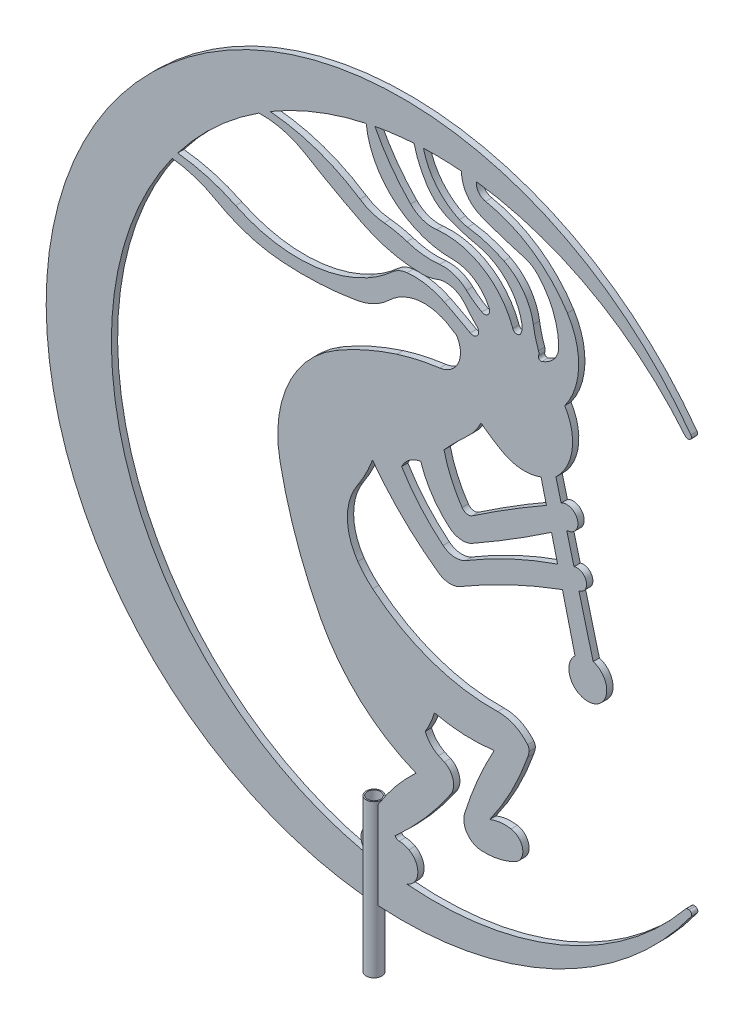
SolidWorks part; units mm, degrees
ref_plane "Front Plane" through (0, 0, 0) normal (0, 0, 1) x (1, 0, 0)
ref_plane "Top Plane" through (0, 0, 0) normal (0, 1, 0) x (1, 0, 0)
ref_plane "Right Plane" through (0, 0, 0) normal (1, 0, 0) x (0, 0, -1)
sketch "Model" plane through (0, 0, 0) normal (0, 0, 1) x (1, 0, 0)
  line L0 (121.8097, -137.6405) -> (107.3418, -82.7355)
  line L1 (68.9055, -1.7853) -> (74.3899, -24.0365)
  line L2 (90.642, -89.9748) -> (103.4341, -141.8749)
  line L3 (102.3813, -63.9103) -> (94.9941, -35.8763)
  line L4 (85.7104, -69.989) -> (85.7156, -69.9871)
  line L5 (107.3418, -82.7355) -> (107.5886, -82.6285)
  line L6 (79.5971, -45.1632) -> (85.7156, -69.9871)
  line L7 (89.3465, -14.4437) -> (84.0088, 5.8125)
  line L8 (218.8133, 106.219) -> (219.3212, 106.382)
  line L10 (219.2116, -307.2942) -> (218.6877, -307.1821)
  arc A0 (95.7332, 155.5808) -> (12.6305, 212.2913) centre (-11.4798, 87.7167) ccw
  arc A1 (8.2558, 196.9794) -> (52.0641, 182.6078) centre (178.4836, 641.9205) ccw
  arc A2 (-29.5648, -27.2149) -> (-5.8467, -3.3002) centre (227.3937, -258.3419) cw
  arc A3 (8.0143, 15.1922) -> (-5.8467, -3.3002) centre (-47.8361, 42.6139) cw
  arc A4 (29.2299, 1.0837) -> (68.9055, -1.7853) centre (52.0641, 41.087) ccw
  arc A5 (29.2299, 1.0837) -> (8.0143, 15.1922) centre (121.9361, 163.4954) cw
  arc A6 (52.0641, 182.6078) -> (65.2981, 174.6762) centre (44.4263, 154.8579) cw
  arc A7 (65.2981, 174.6762) -> (86.8758, 121.8798) centre (8.3347, 120.5878) cw
  arc A8 (-0.6887, -70.7111) -> (-11.2744, -68.6714) centre (-4.9624, -64.4021) cw
  arc A9 (-60.0703, 227.0897) -> (-99.7497, 222.082) centre (-38.8663, -100.6327) ccw
  arc A10 (-46.5893, 196.4008) -> (-60.0703, 227.0897) centre (35.7624, 250.8815) cw
  arc A11 (-14.1146, 183.0061) -> (-50.4739, 227.5698) centre (14.0002, 243.0593) cw
  arc A12 (-46.5893, 196.4008) -> (-24.0961, 178.1484) centre (-6.3186, 223.0423) ccw
  arc A13 (-24.0961, 178.1484) -> (3.9241, 169.7219) centre (39.4106, 338.5236) ccw
  arc A14 (3.9241, 169.7219) -> (49.5503, 123.0035) centre (-8.1491, 112.2919) cw
  arc A15 (12.6305, 212.2913) -> (3.3298, 225.0528) centre (14.8319, 223.6657) cw
  arc A16 (219.2116, -307.2942) -> (221.1211, -312.2576) centre (218.5471, -310.3989) cw
  arc A17 (-14.1146, 183.0061) -> (-5.5582, 180.5421) centre (-2.0774, 208.7175) ccw
  arc A18 (-5.5582, 180.5421) -> (31.342, 169.3123) centre (-19.3337, 69.036) cw
  arc A19 (31.342, 169.3123) -> (61.1081, 128.3223) centre (6.3519, 119.8622) cw
  arc A20 (61.1081, 128.3223) -> (66.3204, 107.8468) centre (170.0568, 145.1553) ccw
  arc A21 (66.3204, 107.8468) -> (66.3719, 103.3846) centre (59.91, 105.5413) cw
  arc A22 (66.3719, 103.3846) -> (69.6967, 100.1031) centre (68.8405, 102.5607) ccw
  arc A23 (69.6967, 100.1031) -> (81.0885, 107.3404) centre (59.9886, 127.9683) ccw
  arc A24 (86.8758, 121.8798) -> (81.0885, 107.3404) centre (66.5583, 121.5456) cw
  arc A25 (-103.9493, -422.5267) -> (-113.1901, -404.8498) centre (-100.2902, -409.36) cw
  arc A26 (-65.1573, -396.5896) -> (-67.154, -427.8197) centre (-73.4199, -411.7402) cw
  arc A27 (-65.1573, -396.5896) -> (-75.1065, -393.8665) centre (-75.8921, -416.2735) ccw
  arc A28 (-75.1065, -393.8665) -> (-79.2674, -391.326) centre (-74.9325, -388.9038) cw
  arc A29 (-39.317, -263.2371) -> (-48.6228, -284.1924) centre (-123.7076, -238.305) cw
  arc A30 (-39.317, -263.2371) -> (21.3409, -266.0287) centre (-1.4435, -100.6993) ccw
  arc A31 (-58.002, -325.6124) -> (-154.7207, -237.9942) centre (12.4799, -150.6184) cw
  arc A32 (-154.7207, -237.9942) -> (-196.0476, -120.592) centre (232.0704, -35.8647) cw
  arc A33 (-196.0476, -120.592) -> (-139.8027, 5.0686) centre (-79.2116, -97.4694) cw
  arc A34 (-139.8027, 5.0686) -> (-77.4813, 32.9433) centre (14.0327, -255.266) cw
  arc A35 (-77.4813, 32.9433) -> (-33.8564, 42.5936) centre (-2.052, -204.6097) cw
  arc A36 (-33.8564, 42.5936) -> (-16.4133, 79.074) centre (-36.9286, 66.473) ccw
  arc A37 (-16.4133, 79.074) -> (-18.4846, 80.9218) centre (-20.5275, 76.5469) ccw
  arc A38 (-18.4846, 80.9218) -> (-21.9659, 82.9295) centre (-8.6161, 102.0558) cw
  arc A39 (-21.9659, 82.9295) -> (-65.2774, 88.8876) centre (-49.4478, 43.5563) ccw
  arc A40 (-65.2774, 88.8876) -> (-85.2911, 76.5469) centre (-47.242, 37.2396) ccw
  arc A41 (-305.4745, 91.1267) -> (-103.9493, -422.5267) centre (-38.8663, -100.6327) ccw
  arc A42 (221.1211, -312.2576) -> (-433.4393, -100.6327) centre (-71.949, -100.6327) cw
  arc A43 (215.3849, 107.2324) -> (3.3298, 225.0528) centre (-38.8663, -100.6327) ccw
  arc A44 (220.9232, 111.2662) -> (-433.4393, -100.6327) centre (-71.949, -100.6327) ccw
  arc A45 (-106.7263, 85.4991) -> (-82.2289, 102.979) centre (-170.3417, 200.5596) ccw
  arc A46 (-82.2289, 102.979) -> (-67.154, 109.7518) centre (-64.1994, 83.0122) cw
  arc A47 (-67.154, 109.7518) -> (-29.2788, 102.979) centre (-59.69, 42.2021) cw
  arc A48 (-29.2788, 102.979) -> (-2.9225, 88.8876) centre (-276.6601, -391.4134) cw
  arc A49 (-2.9225, 88.8876) -> (3.9241, 97.8754) centre (-0.1003, 93.8394) ccw
  arc A50 (3.9241, 97.8754) -> (-8.1491, 111.4066) centre (113.7905, 208.056) cw
  arc A51 (-8.1491, 111.4066) -> (-36.9286, 119.0901) centre (-27.7021, 95.9088) ccw
  arc A52 (-36.9286, 119.0901) -> (-51.4493, 116.2754) centre (-51.6135, 155.9855) cw
  arc A53 (-51.4493, 116.2754) -> (-112.4405, 130.625) centre (-52.0051, 250.7061) cw
  arc A54 (-217.5362, 174.9188) -> (-299.9658, 98.5622) centre (-38.8663, -100.6327) ccw
  arc A55 (218.6877, -307.1821) -> (215.5633, -308.2793) centre (218.0231, -310.2868) ccw
  arc A56 (220.9232, 111.2662) -> (219.3212, 106.382) centre (218.3508, 109.4051) cw
  arc A57 (218.8133, 106.219) -> (215.3849, 107.2324) centre (217.8429, 109.2421) cw
  arc A58 (-114.7512, 150.5139) -> (-90.2904, 141.9589) centre (-85.6103, 194.5877) ccw
  arc A59 (-90.2904, 141.9589) -> (-67.154, 137.1455) centre (-99.3003, 40.6406) cw
  arc A60 (-67.154, 137.1455) -> (-34.073, 133.5994) centre (-42.4848, 211.2037) ccw
  arc A61 (-34.073, 133.5994) -> (-6.7662, 124.4171) centre (-30.3684, 99.422) cw
  arc A62 (-6.7662, 124.4171) -> (8.8424, 113.1799) centre (43.1097, 177.2363) ccw
  arc A63 (8.8424, 113.1799) -> (16.2992, 119.9774) centre (11.367, 117.8992) ccw
  arc A64 (16.2992, 119.9774) -> (-21.2664, 144.7136) centre (-20.9675, 104.2748) ccw
  arc A65 (-21.2664, 144.7136) -> (-90.1684, 176.7529) centre (-21.922, 233.4119) cw
  arc A66 (-63.5232, 171.9975) -> (-99.7497, 222.082) centre (81.7961, 315.252) cw
  arc A67 (-90.1684, 176.7529) -> (-108.5768, 220.291) centre (-27.1821, 229.0448) cw
  arc A68 (-63.5232, 171.9975) -> (-36.9861, 162.6656) centre (-40.703, 194.4934) ccw
  arc A69 (-36.9861, 162.6656) -> (40.2486, 114.424) centre (-28.53, 90.2567) cw
  arc A70 (49.5503, 123.0035) -> (48.3769, 113.9977) centre (35.0563, 120.3128) cw
  arc A71 (48.3769, 113.9977) -> (40.2486, 114.424) centre (44.4004, 115.8829) cw
  arc A72 (-58.002, -325.6124) -> (-113.1901, -404.8498) centre (97.7212, -492.9098) ccw
  arc A73 (-79.2674, -391.326) -> (-22.7857, -326.5913) centre (-310.6788, -132.4094) ccw
  arc A74 (-48.6228, -284.1924) -> (-35.1582, -298.8332) centre (-21.9385, -273.1636) ccw
  arc A75 (-29.2494, -301.3735) -> (-22.7857, -326.5913) centre (-37.2219, -316.8542) cw
  arc A76 (-35.1582, -298.8332) -> (-29.2494, -301.3735) centre (-13.9659, -257.6829) ccw
  arc A77 (-102.1873, -72.5597) -> (-117.7533, -102.7718) centre (-242.6554, -19.3028) cw
  arc A78 (-117.7533, -102.7718) -> (-117.1516, -169.0232) centre (-68.8449, -135.456) ccw
  arc A79 (-117.1516, -169.0232) -> (-102.0583, -185.5478) centre (-47.7945, -120.8287) ccw
  arc A80 (-102.0583, -185.5478) -> (24.972, -230.0372) centre (20.3987, -39.4962) ccw
  arc A81 (24.972, -230.0372) -> (55.3056, -244.0475) centre (25.8811, -267.9117) cw
  arc A82 (55.3056, -244.0475) -> (56.744, -249.4103) centre (50.0105, -248.342) cw
  arc A83 (56.744, -249.4103) -> (55.3056, -255.0798) centre (24.9953, -244.3729) cw
  arc A84 (55.3056, -255.0798) -> (16.7788, -329.0067) centre (-224.6282, -156.1955) cw
  arc A85 (-102.1873, -72.5597) -> (-35.0493, -138.1164) centre (139.6179, 107.9208) ccw
  arc A86 (79.5977, -45.1627) -> (-0.7426, -94.9983) centre (-592.0382, 947.9108) cw
  arc A87 (85.7104, -69.989) -> (-7.2272, -113.3575) centre (245.7713, -534.2617) ccw
  arc A88 (90.6542, -89.9703) -> (-12.9594, -139.0475) centre (308.4973, -683.8043) ccw
  arc A89 (-72.6043, -63.3833) -> (-30.5887, -111.6475) centre (91.426, 36.9906) ccw
  arc A90 (-53.219, -49.1619) -> (-23.8984, -92.827) centre (38.3218, -19.3701) ccw
  arc A91 (21.3409, -266.0287) -> (-8.6819, -336.3688) centre (357.7436, -451.1909) ccw
  arc A92 (103.4341, -141.8749) -> (121.8097, -137.6405) centre (116.3925, -156.1205) ccw
  arc A93 (101.7377, -64.1489) -> (107.5886, -82.6285) centre (105.439, -73.1431) cw
  arc A94 (88.6254, -14.8973) -> (95.4492, -35.6339) centre (95.0312, -24.2804) cw
  arc A95 (-53.219, -49.1619) -> (-72.6043, -63.3833) centre (-49.3957, -74.6964) ccw
  arc A96 (-35.0493, -138.1164) -> (-12.9594, -139.0475) centre (-23.2863, -121.547) ccw
  arc A97 (-7.2272, -113.3575) -> (-30.5887, -111.6475) centre (-17.6958, -95.9413) cw
  arc A98 (-0.7426, -94.9983) -> (-23.8984, -92.827) centre (-10.7648, -77.3215) cw
  arc A99 (-67.154, -427.8197) -> (215.5633, -308.2793) centre (-38.8663, -100.6327) ccw
  arc A100 (74.3848, -24.0394) -> (74.3899, -24.0365) centre (-3.546, 113.0154) ccw
  arc A101 (94.9941, -35.8763) -> (95.4492, -35.6339) centre (176.6494, -188.6622) cw
  arc A102 (-8.6819, -336.3688) -> (8.0619, -360.5258) centre (9.0842, -341.9359) ccw
  arc A103 (8.0619, -360.5258) -> (42.8516, -352.9631) centre (11.7399, -293.6444) ccw
  arc A104 (42.8516, -352.9631) -> (38.535, -326.4051) centre (36.2645, -340.404) ccw
  arc A105 (38.535, -326.4051) -> (16.7788, -329.0067) centre (32.1839, -365.5637) ccw
  arc A106 (8.2558, 196.9794) -> (-11.7911, 226.657) centre (19.4044, 226.1197) cw
  arc A107 (-108.5768, 220.291) -> (-206.0886, 182.0125) centre (-38.8663, -100.6327) ccw
  arc A108 (-11.7911, 226.657) -> (-50.4739, 227.5698) centre (-38.8663, -100.6327) ccw
  arc A109 (-106.7263, 85.4991) -> (-241.1459, 81.8505) centre (-177.4581, 213.4308) cw
  arc A110 (-241.1459, 81.8505) -> (-299.9658, 98.5622) centre (-318.1026, -77.1433) ccw
  arc A111 (-85.2911, 76.5469) -> (-117.7148, 60.0232) centre (-128.4188, 121.1009) cw
  arc A112 (-117.7148, 60.0232) -> (-193.9003, 56.0871) centre (-171.8761, 369.0725) cw
  arc A113 (-193.9003, 56.0871) -> (-260.8316, 76.5469) centre (-182.9576, 211.593) cw
  arc A114 (-260.8316, 76.5469) -> (-305.4745, 91.1267) centre (-317.7956, -22.2377) ccw
  arc A115 (-114.7512, 150.5139) -> (-206.0886, 182.0125) centre (-221.561, -11.0296) ccw
  arc A116 (-112.4405, 130.625) -> (-170.3417, 162.6656) centre (267.6022, 885.7442) cw
  arc A117 (-170.3417, 162.6656) -> (-217.5362, 174.9188) centre (-214.4284, 89.8752) ccw
  arc A147 (93.0134, 72.9708) -> (95.7332, 155.5808) centre (33.6379, 116.2754) ccw
  arc A148 (-29.5648, -27.2149) -> (-11.2744, -68.6714) centre (94.0123, 2.5434) ccw
  arc A149 (-0.6887, -70.7111) -> (74.3848, -24.0394) centre (632.0172, -1004.7314) cw
  arc A329 (93.0134, 72.9708) -> (84.0088, 5.8125) centre (47.2696, 44.9213) cw
  point P54 (82.1503, 147.451)
  dimension "D1" = 7.6203
  dimension "D2" = 20.3203
  dimension "D3" = 20.3203
  dimension "D4" = 3.175
extrude "Boss-Extrude1" add sketch "Model" along normal blind 6.35
ref_plane "Plane2" through (0, -486.578, 0) normal (0, -1, 0) x (1, 0, 0)
sketch "Sketch2" plane through (0, -486.578, 0) normal (0, -1, 0) x (1, 0, 0)
  circle A0 centre (-103.9109, 3.1268) radius 7.9375
  dimension "D1" = 15.875
extrude "Boss-Extrude2" add sketch "Sketch2" along direction (0, -1, 0) on the side against the normal blind 116.84 and the other way blind 38.1
sketch "Sketch3" plane through (0, -524.678, 0) normal (0, -1, 0) x (1, 0, 0)
  circle A0 centre (-103.9109, 3.1268) radius 6.7143
extrude "Cut-Extrude1" cut sketch "Sketch3" against normal up to next
